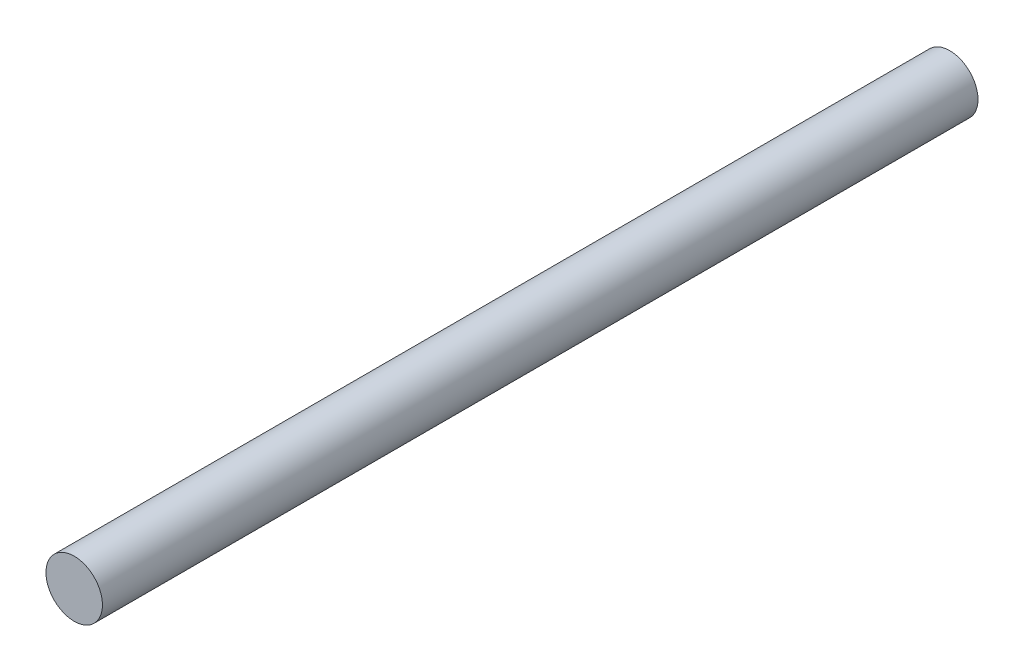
SolidWorks part; units mm, degrees
ref_plane "Front Plane" through (0, 0, 0) normal (0, 0, 1) x (1, 0, 0)
ref_plane "Top Plane" through (0, 0, 0) normal (0, 1, 0) x (1, 0, 0)
ref_plane "Right Plane" through (0, 0, 0) normal (1, 0, 0) x (0, 0, -1)
sketch "Sketch1" plane through (0, 0, 0) normal (0, 0, 1) x (1, 0, 0)
  circle A0 centre (-51.9087, 20.03) radius 3.175
  dimension "D1" = 6.35
extrude "Boss-Extrude1" add sketch "Sketch1" along normal blind 98.425
